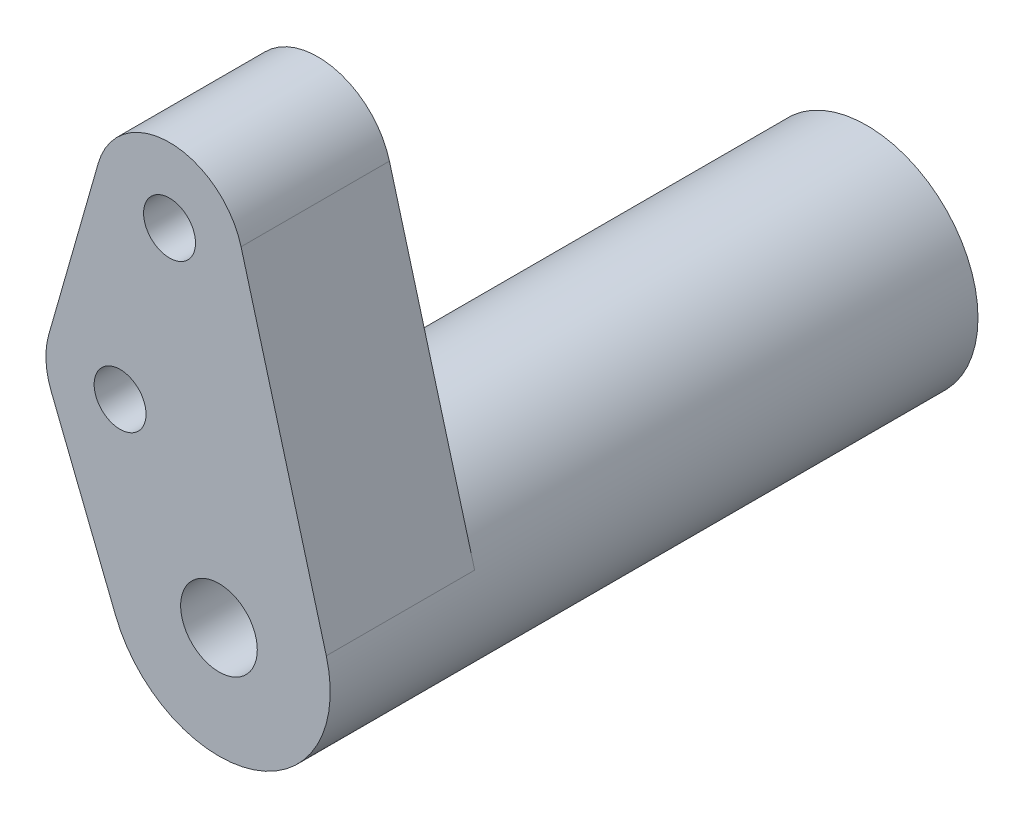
SolidWorks part; units mm, degrees
ref_plane "Alzado" through (0, 0, 0) normal (0, 0, 1) x (1, 0, 0)
ref_plane "Planta" through (0, 0, 0) normal (0, 1, 0) x (1, 0, 0)
ref_plane "Vista lateral" through (0, 0, 0) normal (1, 0, 0) x (0, 0, -1)
ref_plane "Plano1" through (0, 0, 14) normal (0, 0, 1) x (1, 0, 0)
sketch "Sk_Columna" plane through (0, 0, 14) normal (0, 0, 1) x (1, 0, 0)
  circle A0 centre (-36, -62) radius 9
  circle A1 centre (-36, -62) radius 3.1
extrude "Columna" add sketch "Sk_Columna" along normal blind 40.4
ref_plane "Plano2" through (0, 0, 54.4) normal (0, 0, 1) x (1, 0, 0)
sketch "Sk_Cuerpo_inferior" plane through (0, 0, 54.4) normal (0, 0, 1) x (1, 0, 0)
  line L0 (-49.5754, -52.2169) -> (-44.3631, -65.3254)
  line L1 (-27.3188, -59.626) -> (-34.2125, -34.4173)
  line L2 (-45.7691, -34.3517) -> (-49.7691, -48.3517)
  arc A0 (-44.3631, -65.3254) -> (-27.3188, -59.626) centre (-36, -62) ccw
  arc A1 (-34.2125, -34.4173) -> (-45.7691, -34.3517) centre (-40, -36) ccw
  arc A2 (-49.7691, -48.3517) -> (-49.5754, -52.2169) centre (-44, -50) ccw
  circle A3 centre (-40, -36) radius 2.1
  circle A4 centre (-44, -50) radius 2.1
  circle A5 centre (-36, -62) radius 3.1
extrude "Cuerpo_inferior" add sketch "Sk_Cuerpo_inferior" along normal blind 12
